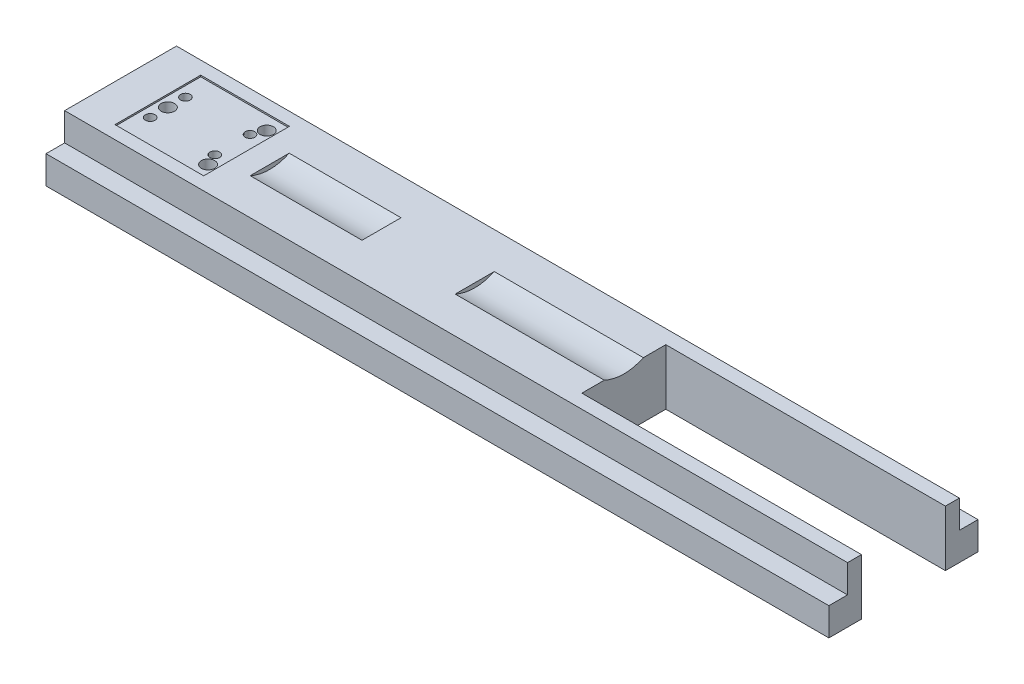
SolidWorks part; units mm, degrees
ref_plane "Front Plane" through (0, 0, 0) normal (0, 0, 1) x (1, 0, 0)
ref_plane "Top Plane" through (0, 0, 0) normal (0, 1, 0) x (1, 0, 0)
ref_plane "Right Plane" through (0, 0, 0) normal (1, 0, 0) x (0, 0, -1)
sketch "Sketch1" plane through (0, 0, 0) normal (0, 1, 0) x (1, 0, 0)
  line L1 (0, 0) -> (266.7, 0)
  line L2 (0, 0) -> (0, -50.8)
  line L3 (0, -50.8) -> (266.7, -50.8)
  line L4 (266.7, 0) -> (266.7, -50.8)
  dimension "D1" = 50.8
  dimension "D2" = 266.7
extrude "Boss-Extrude1" add sketch "Sketch1" against normal blind 19.05
sketch "Sketch2" plane through (0, 0, 0) normal (0, 1, 0) x (1, 0, 0)
  line L0 (0, 0) -> (0, -50.8) construction
  line L1 (12.7, -40.005) -> (42.926, -40.005)
  line L2 (12.7, -40.005) -> (12.7, -10.795)
  line L3 (12.7, -10.795) -> (42.926, -10.795)
  line L4 (42.926, -40.005) -> (42.926, -10.795)
  point P6 (0, -25.4)
  point P7 (12.7, -25.4)
  dimension "D1" = 29.21
  dimension "D2" = 30.226
  dimension "D3" = 12.7
extrude "Cut-Extrude1" cut sketch "Sketch2" against normal blind 0.508
sketch "Sketch3" plane through (0, -0.508, 0) normal (0, 1, 0) x (1, 0, 0)
  line L1 (0, 0) -> (0, -50.8) construction
  line L3 (12.7, -10.795) -> (12.7, -40.005) construction
  circle A0 centre (16.1036, -25.4) radius 2.286
  circle A1 centre (16.1036, -19.4056) radius 1.651
  circle A2 centre (16.1036, -31.3944) radius 1.651
  circle A3 centre (39.8018, -15.4051) radius 2.286
  circle A4 centre (39.8018, -35.3949) radius 2.286
  circle A5 centre (38.1, -19.4056) radius 1.651
  circle A6 centre (38.1, -31.3944) radius 1.651
  point P6 (0, -25.4)
  dimension "D1" = 4.572
  dimension "D5" = 3.302
  dimension "D6" = 3.302
  dimension "D8" = 4.572
  dimension "D9" = 4.572
  dimension "D14" = 3.302
  dimension "D16" = 3.302
  dimension "D2" = 3.4036
  dimension "D3" = 5.9944
  dimension "D4" = 5.9944
  dimension "D7" = 23.6982
  dimension "D10" = 23.6982
  dimension "D11" = 9.9949
  dimension "D12" = 9.9949
  dimension "D13" = 21.9964
  dimension "D15" = 21.9964
  dimension "D17" = 5.9944
extrude "Cut-Extrude2" cut sketch "Sketch3" against normal through all
sketch "Sketch5" plane through (266.7, 0, 0) normal (1, 0, 0) x (0, 0, -1)
  line L0 (-50.8, -19.05) -> (0, -19.05) construction
  line L1 (-40.005, -0.508) -> (-10.795, -0.508) construction
  circle A0 centre (-25.4, 13.9954) radius 15.494
  point P4 (-25.4, -19.05)
  dimension "D1" = 30.988
  dimension "D2" = 14.5034
extrude "Cut-Extrude3" cut sketch "Sketch5" against normal blind 127 from offset 19.05
sketch "Sketch6" plane through (266.7, 0, 0) normal (1, 0, 0) x (0, 0, -1)
  line L1 (-50.8, 0) -> (-44.45, 0)
  line L2 (-50.8, 0) -> (-50.8, -9.525)
  line L3 (-50.8, -9.525) -> (-44.45, -9.525)
  line L4 (-44.45, 0) -> (-44.45, -9.525)
  line L5 (0, 0) -> (-6.35, 0)
  line L6 (0, 0) -> (0, -9.525)
  line L7 (0, -9.525) -> (-6.35, -9.525)
  line L8 (-6.35, 0) -> (-6.35, -9.525)
  dimension "D1" = 6.35
  dimension "D2" = 9.525
  dimension "D3" = 9.525
  dimension "D4" = 6.35
extrude "Cut-Extrude4" cut sketch "Sketch6" against normal through all
sketch "Sketch7" plane through (266.7, 0, 0) normal (1, 0, 0) x (0, 0, -1)
  line L0 (-44.45, 0) -> (-6.35, 0) construction
  line L1 (-39.7002, 0) -> (-11.0998, 0)
  line L2 (-39.7002, 0) -> (-39.7002, -19.05)
  line L3 (-39.7002, -19.05) -> (-11.0998, -19.05)
  line L4 (-11.0998, 0) -> (-11.0998, -19.05)
  line L5 (-50.8, -19.05) -> (0, -19.05) construction
  line L6 (-44.45, -9.525) -> (-44.45, 0) construction
  line L7 (-6.35, 0) -> (-6.35, -9.525) construction
  dimension "D1" = 4.7498
  dimension "D2" = 4.7498
extrude "Cut-Extrude5" cut sketch "Sketch7" against normal blind 95.25
sketch "Sketch8" plane through (266.7, 0, 0) normal (1, 0, 0) x (0, 0, -1)
  circle A0 centre (-25.4, 13.9954) radius 15.494
  dimension "D1" = 30.988
extrude "Cut-Extrude6" cut sketch "Sketch8" against normal blind 38.1 from offset 177.8
sketch "Sketch9" plane through (0, -19.05, 0) normal (0, -1, 0) x (1, 0, 0)
  line L0 (0, 0) -> (0, 50.8) construction
  line L1 (7.9248, 7.9248) -> (47.625, 7.9248)
  line L2 (7.9248, 7.9248) -> (7.9248, 42.8752)
  line L3 (7.9248, 42.8752) -> (47.625, 42.8752)
  line L4 (47.625, 7.9248) -> (47.625, 42.8752)
  line L5 (0, 50.8) -> (266.7, 50.8) construction
  line L6 (266.7, 0) -> (0, 0) construction
  dimension "D1" = 7.9248
  dimension "D2" = 7.9248
  dimension "D3" = 7.9248
  dimension "D4" = 47.625
extrude "Cut-Extrude7" cut sketch "Sketch9" against normal blind 3.9624
